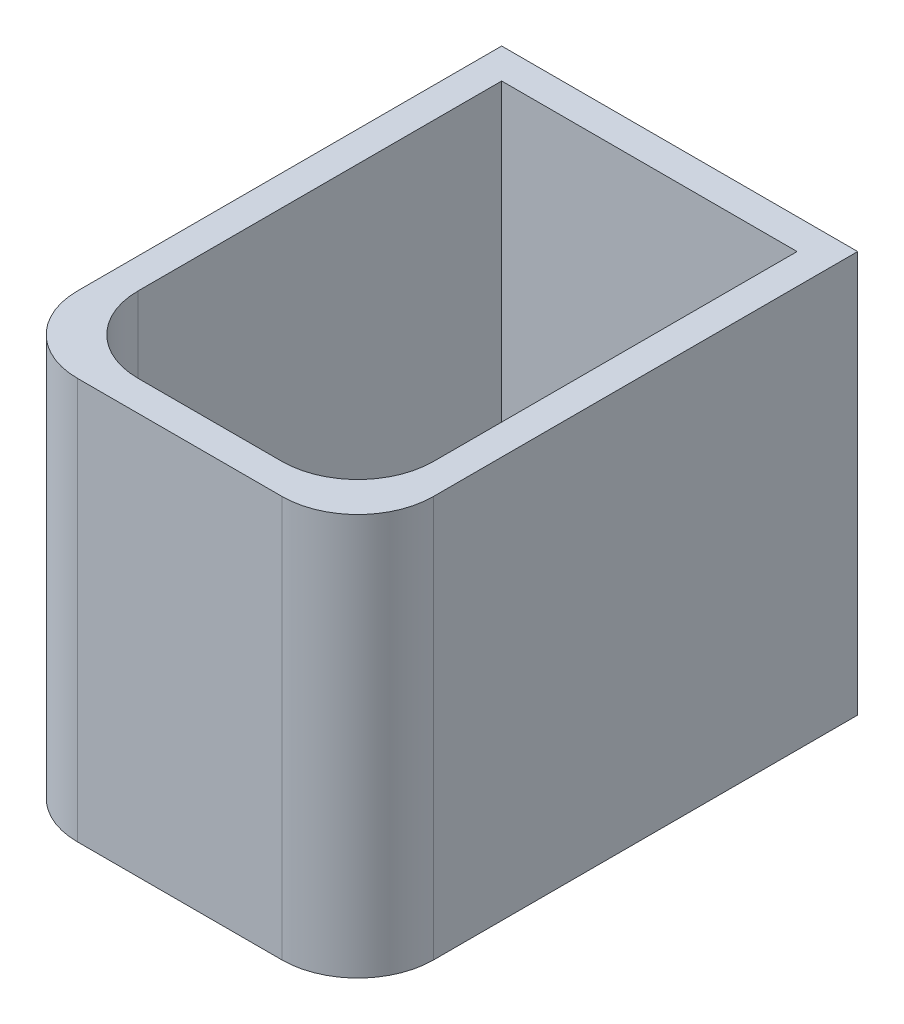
SolidWorks part; units mm, degrees
ref_plane "前视基准面" through (0, 0, 0) normal (0, 0, 1) x (1, 0, 0)
ref_plane "上视基准面" through (0, 0, 0) normal (0, 1, 0) x (1, 0, 0)
ref_plane "右视基准面" through (0, 0, 0) normal (1, 0, 0) x (0, 0, -1)
other "Configuration Table"
sketch "草图1" plane through (0, 0, 0) normal (0, 1, 0) x (1, 0, 0)
  line L1 (-2.35, -3.3) -> (2.35, -3.3)
  line L2 (-2.35, -3.3) -> (-2.35, 3.3)
  line L3 (-2.35, 3.3) -> (2.35, 3.3)
  line L4 (2.35, -3.3) -> (2.35, 3.3)
  line L5 (-2.35, -3.3) -> (2.35, 3.3) construction
  line L6 (-2.35, 3.3) -> (2.35, -3.3) construction
  point P0 (0, 0)
  dimension "D1" = 4.7
  dimension "D2" = 6.6
extrude "凸台-拉伸1" add sketch "草图1" along normal blind 0.3
sketch "草图2" plane through (0, 0.3, 0) normal (0, 1, 0) x (1, 0, 0)
  line L1 (-2.35, -3.3) -> (2.35, -3.3)
  line L2 (-2.35, -3.3) -> (-2.35, 3.3)
  line L3 (-2.35, 3.3) -> (2.35, 3.3)
  line L4 (2.35, -3.3) -> (2.35, 3.3)
  line L5 (-2.35, -3.3) -> (2.35, 3.3) construction
  line L6 (-2.35, 3.3) -> (2.35, -3.3) construction
  line L7 (-1.95, -2.9) -> (1.95, -2.9)
  line L8 (-1.95, -2.9) -> (-1.95, 2.9)
  line L9 (-1.95, 2.9) -> (1.95, 2.9)
  line L10 (1.95, -2.9) -> (1.95, 2.9)
  line L11 (-1.95, -2.9) -> (1.95, 2.9) construction
  line L12 (-1.95, 2.9) -> (1.95, -2.9) construction
  point P0 (0, 0)
  point P7 (0, 0)
  dimension "D1" = 0.4
  dimension "D2" = 0.4
extrude "凸台-拉伸2" add sketch "草图2" along normal blind 5
sketch "草图3" plane through (0, 5.3, 0) normal (0, 1, 0) x (1, 0, 0)
  line L1 (-2.35, -3.3) -> (2.35, -3.3)
  line L2 (-2.35, -3.3) -> (-2.35, 3.3)
  line L3 (-2.35, 3.3) -> (2.35, 3.3)
  line L4 (2.35, -3.3) -> (2.35, 3.3)
  line L5 (-2.35, -3.3) -> (2.35, 3.3) construction
  line L6 (-2.35, 3.3) -> (2.35, -3.3) construction
  point P0 (0, 0)
extrude "凸台-拉伸3" [suppressed] add sketch "草图3" along normal blind 0.3
fillet "圆角1" radius 1 4 edges at (-2.35, 2.65, 3.3) (-1.95, 2.8, 2.9) (1.95, 2.8, 2.9) (2.35, 2.65, 3.3)
